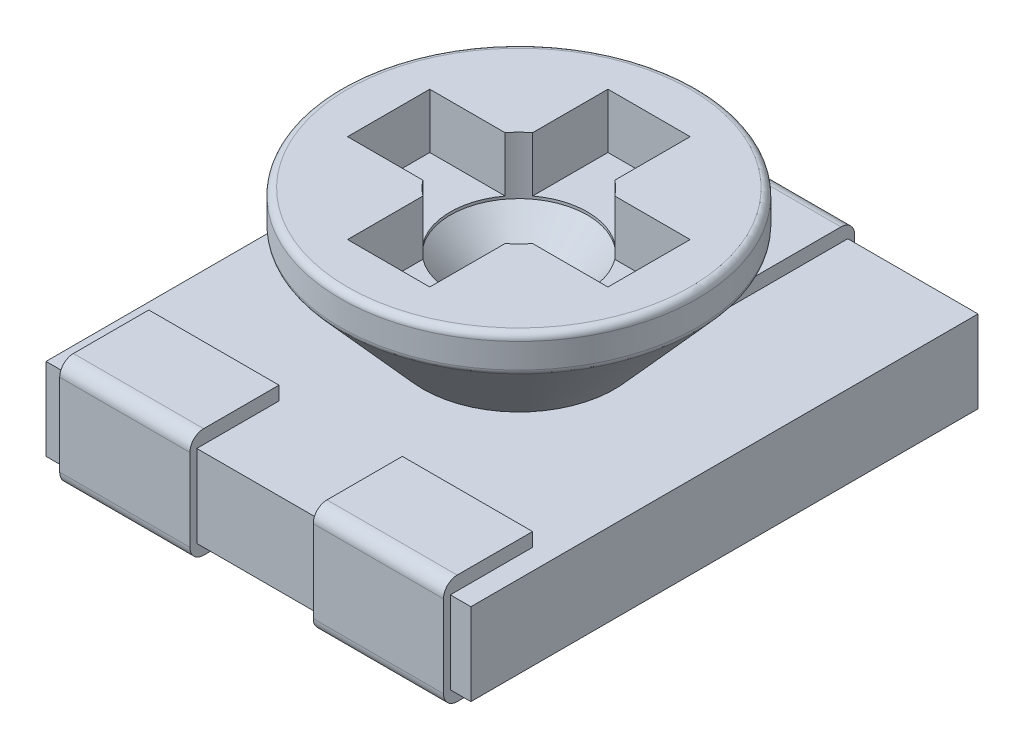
SolidWorks part; units mm, degrees
ref_plane "Front" through (0, 0, 0) normal (0, 0, 1) x (1, 0, 0)
ref_plane "Top" through (0, 0, 0) normal (0, 1, 0) x (1, 0, 0)
ref_plane "Right" through (0, 0, 0) normal (1, 0, 0) x (0, 0, -1)
sketch "Эскиз1" plane through (0, 0, 0) normal (0, 1, 0) x (1, 0, 0)
  line L0 (0, 1.8) -> (0, -1.9) construction
  line L1 (-1.55, -1.9) -> (1.55, -1.9)
  line L2 (-1.55, -1.9) -> (-1.55, 1.8)
  line L3 (-1.55, 1.8) -> (1.55, 1.8)
  line L4 (1.55, -1.9) -> (1.55, 1.8)
  dimension "D1" = 3.1
  dimension "D2" = 1.9
  dimension "D3" = 1.8
  dimension "D4" = 3.7
extrude "Вытянуть1" add sketch "Эскиз1" along normal blind 0.6 from offset 0.1
sketch "Эскиз2" plane through (0, 0, 0) normal (0, 1, 0) x (1, 0, 0)
  line L0 (0, 0) -> (0, -1.9) construction
  line L1 (-0.6, 1.85) -> (0.6, 1.85)
  line L2 (-0.6, 1.85) -> (-0.6, 0.9)
  line L3 (-0.6, 0.9) -> (0.6, 0.9)
  line L4 (0.6, 1.85) -> (0.6, 0.9)
  line L5 (-1.4, -1.3) -> (-0.45, -1.3)
  line L6 (-1.4, -1.3) -> (-1.4, -1.95)
  line L7 (-1.4, -1.95) -> (-0.45, -1.95)
  line L8 (-0.45, -1.3) -> (-0.45, -1.95)
  line L9 (-1.55, -1.9) -> (1.55, -1.9) construction
  line L10 (0.45, -1.3) -> (0.45, -1.95)
  line L11 (1.4, -1.95) -> (0.45, -1.95)
  line L12 (1.4, -1.3) -> (1.4, -1.95)
  line L13 (1.4, -1.3) -> (0.45, -1.3)
  dimension "D1" = 1.85
  dimension "D2" = 1.95
  dimension "D3" = 1.2
  dimension "D4" = 0.95
  dimension "D5" = 0.9
  dimension "D6" = 1.3
  dimension "D7" = 0.9
extrude "Вытянуть2" add sketch "Эскиз2" along normal blind 0.8
fillet "Скругление1" radius 0.1 6 edges at (0, 0, -1.85) (0, 0.8, -1.85) (0.925, 0, 1.95) (-0.925, 0, 1.95) (0.925, 0.8, 1.95) (-0.925, 0.8, 1.95)
sketch "Эскиз3" plane through (0, 0, 0) normal (1, 0, 0) x (0, 0, -1)
  line L0 (0, 0) -> (0, 1.62) construction
  line L1 (0.5, 1.62) -> (1.25, 1.62)
  line L2 (1.3, 1.57) -> (1.3, 1.3891)
  line L3 (1.2872, 1.3558) -> (0.7, 0.7)
  line L4 (-1.9, 0.7) -> (1.8, 0.7) construction
  line L5 (0.7, 0.7) -> (0.3, 0.7)
  line L7 (0.3, 0.7) -> (0.3, 1)
  line L8 (0.3, 1) -> (0.5, 1.2)
  line L9 (0.5, 1.2) -> (0.5, 1.62)
  arc A0 (1.3, 1.3891) -> (1.2872, 1.3558) centre (1.25, 1.3891) cw
  arc A1 (1.25, 1.62) -> (1.3, 1.57) centre (1.25, 1.57) cw
  point P11 (1.3, 1.37)
  point P14 (1.3, 1.62)
  dimension "D5" = 0.05
  dimension "D1" = 1.62
  dimension "D2" = 1.3
  dimension "D3" = 0.25
  dimension "D4" = 0.6
  dimension "D6" = 1
  dimension "D7" = 45
  dimension "D8" = 1.4
  dimension "D9" = 0.3
revolve "Повернуть1" add sketch "Эскиз3" angle 360 about L0
sketch "Эскиз4" plane through (0, 1.62, 0) normal (0, 1, 0) x (1, 0, 0)
  line L0 (0, 0) -> (-0.95, 0) construction
  line L1 (-0.95, 0.3) -> (-0.3, 0.3)
  line L2 (-0.95, 0.3) -> (-0.95, -0.3)
  line L3 (-0.95, -0.3) -> (-0.3, -0.3)
  line L4 (0.95, 0.3) -> (0.95, -0.3)
  line L5 (-0.3, 0.95) -> (0.3, 0.95)
  line L6 (-0.3, 0.95) -> (-0.3, 0.3)
  line L7 (-0.3, -0.95) -> (0.3, -0.95)
  line L8 (0.3, 0.95) -> (0.3, 0.3)
  line L9 (0, 0) -> (0, 0.95) construction
  line L10 (-0.3, -0.3) -> (-0.3, -0.95)
  line L11 (0.3, 0.3) -> (0.95, 0.3)
  line L12 (0.3, -0.3) -> (0.3, -0.95)
  line L13 (0.3, -0.3) -> (0.95, -0.3)
  dimension "D1" = 0.6
  dimension "D2" = 1.9
extrude "Вытянуть3" cut sketch "Эскиз4" against normal blind 0.4
